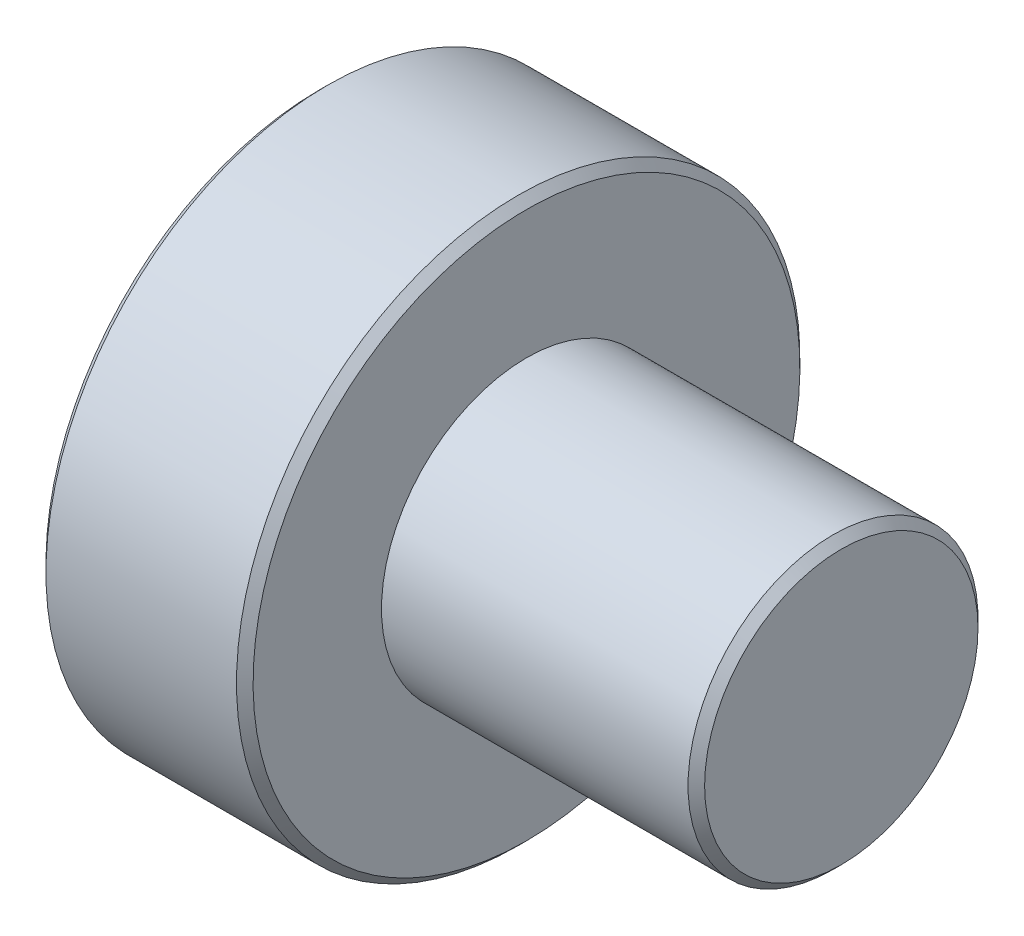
SolidWorks part; units mm, degrees
ref_plane "Plan de face" through (0, 0, 0) normal (0, 0, 1) x (1, 0, 0)
ref_plane "Plan de dessus" through (0, 0, 0) normal (0, 1, 0) x (1, 0, 0)
ref_plane "Plan de droite" through (0, 0, 0) normal (1, 0, 0) x (0, 0, -1)
sketch "Esquisse1" plane through (0, 0, 0) normal (0, 0, 1) x (1, 0, 0)
  line L0 (-3.15, 0) -> (3.15, 0)
  line L1 (-3.15, 0) -> (-3.15, 3.4)
  line L2 (-3.15, 3.4) -> (-0.65, 3.4)
  line L3 (-0.65, 3.4) -> (-0.65, 1.75)
  line L4 (-0.65, 1.75) -> (3.15, 1.75)
  line L5 (3.15, 1.75) -> (3.15, 0)
  dimension "D1" = 1.75
  dimension "D2" = 3.4
  dimension "D3" = 2.5
  dimension "D4" = 3.8
revolve "Révolution1" add sketch "Esquisse1" angle 360 about L0
chamfer "Chanfrein1" distance 0.1 angle 45 3 edges at (3.15, -1.75, 0) (-0.65, -3.4, 0) (-3.15, -3.4, 0)
